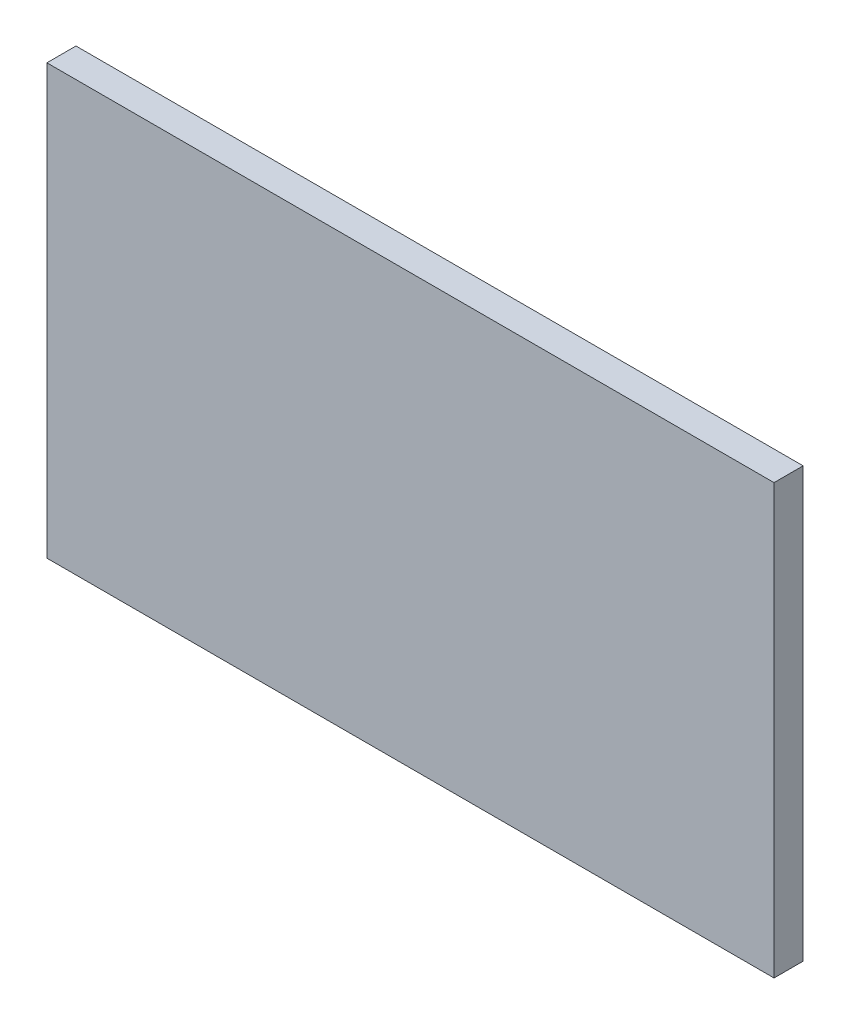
SolidWorks part; units mm, degrees
ref_plane "Front" through (0, 0, 0) normal (0, 0, 1) x (1, 0, 0)
ref_plane "Top" through (0, 0, 0) normal (0, 1, 0) x (1, 0, 0)
ref_plane "Right" through (0, 0, 0) normal (1, 0, 0) x (0, 0, -1)
sketch "Sketch1" plane through (0, 0, 0) normal (0, 0, 1) x (1, 0, 0)
  line L1 (0, 0) -> (-25.4, 0)
  line L2 (0, 0) -> (0, -14.986)
  line L3 (0, -14.986) -> (-25.4, -14.986)
  line L4 (-25.4, 0) -> (-25.4, -14.986)
  dimension "D1" = 25.4
  dimension "D2" = 14.986
extrude "Boss-Extrude1" add sketch "Sketch1" along normal blind 1.016
